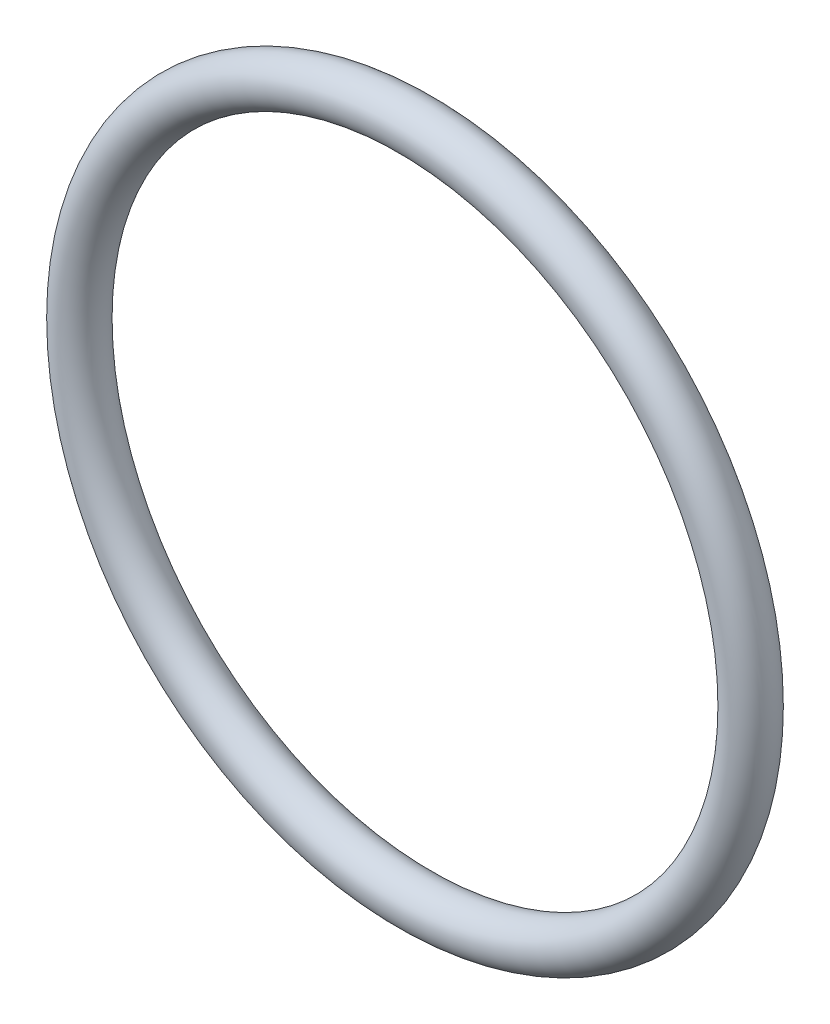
SolidWorks part; units mm, degrees
ref_plane "Ebene vorne" through (0, 0, 0) normal (0, 0, 1) x (1, 0, 0)
ref_plane "Ebene oben" through (0, 0, 0) normal (0, 1, 0) x (1, 0, 0)
ref_plane "Ebene rechts" through (0, 0, 0) normal (1, 0, 0) x (0, 0, -1)
sketch "Skizze1" plane through (0, 0, 0) normal (1, 0, 0) x (0, 0, -1)
  line L0 (0, 0) -> (72.5638, 0) construction
  line L1 (0, 14.5) -> (0, 0) construction
  circle A0 centre (0, 14.5) radius 1
  dimension "D1" = 2
  dimension "D2" = 27
revolve "Rotation1" add sketch "Skizze1" angle 360 about L0
sketch "Skizze2" [suppressed] plane through (0, 0, 0) normal (1, 0, 0) x (0, 0, -1)
  line L0 (0, 0) -> (2.8234, 0) construction
  line L1 (0, 15.95) -> (0, 0) construction
  circle A0 centre (0, 15.95) radius 1
  dimension "D1" = 2
  dimension "D2" = 29.9
revolve "Rotation2" [suppressed] add sketch "Skizze2" angle 360 about L0
